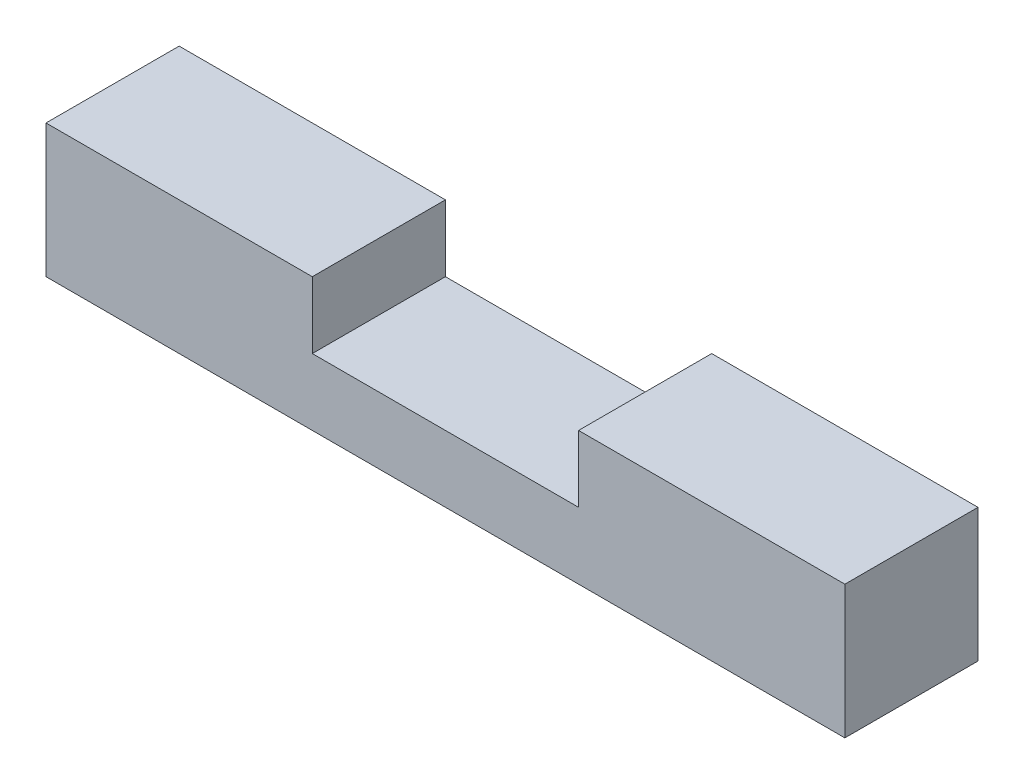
SolidWorks part; units mm, degrees
ref_plane "Front Plane" through (0, 0, 0) normal (0, 0, 1) x (1, 0, 0)
ref_plane "Top Plane" through (0, 0, 0) normal (0, 1, 0) x (1, 0, 0)
ref_plane "Right Plane" through (0, 0, 0) normal (1, 0, 0) x (0, 0, -1)
sketch "Sketch1" plane through (0, 0, 0) normal (0, 1, 0) x (1, 0, 0)
  line L1 (0, 0) -> (120, 0)
  line L2 (0, 0) -> (0, 20)
  line L3 (0, 20) -> (120, 20)
  line L4 (120, 0) -> (120, 20)
  dimension "D1" = 120
  dimension "D2" = 20
extrude "Extrude1" add sketch "Sketch1" along normal blind 20
sketch "Sketch2" plane through (0, 0, 0) normal (0, 0, 1) x (1, 0, 0)
  line L0 (0, 20) -> (120, 20) construction
  line L1 (40, 20) -> (80, 20)
  line L2 (40, 20) -> (40, 10)
  line L3 (40, 10) -> (80, 10)
  line L4 (80, 20) -> (80, 10)
  line L5 (0, 20) -> (0, 0) construction
  dimension "D1" = 10
  dimension "D2" = 40
  dimension "D3" = 40
extrude "Extrude2" cut sketch "Sketch2" against normal through all
